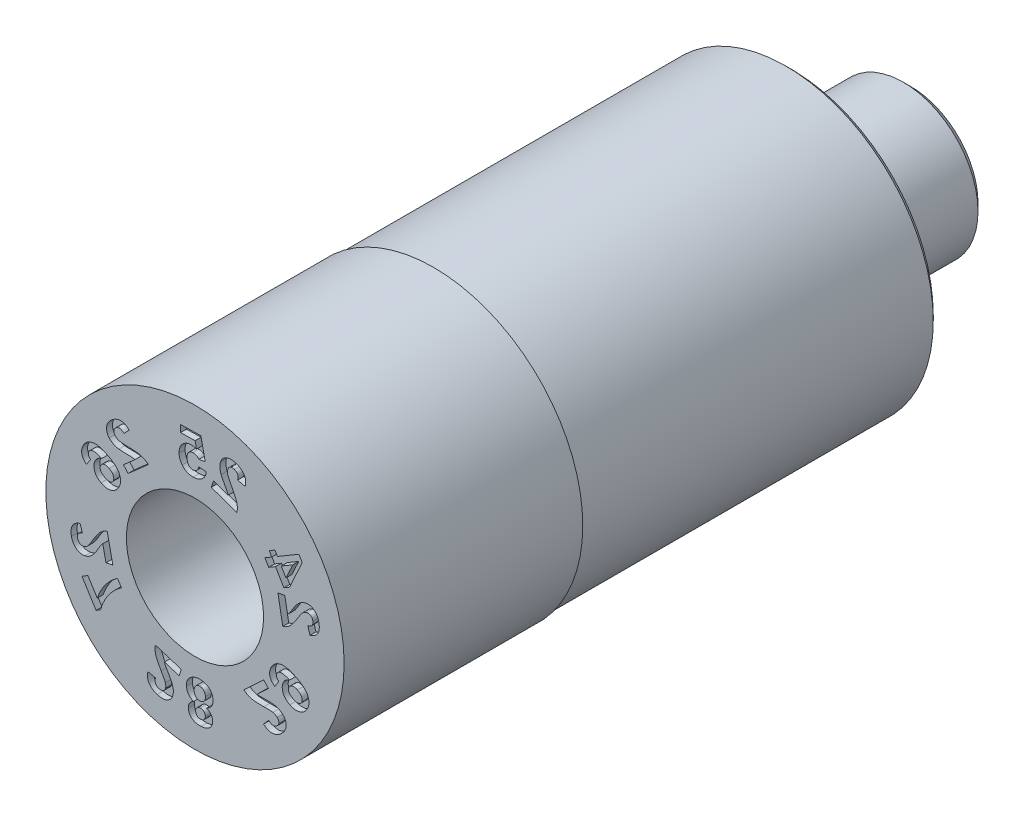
SolidWorks part; units mm, degrees
other "<M5 X .8 SHSS>-<Revolve1>"
ref_plane "Front Plane" through (0, 0, 0) normal (0, 0, 1) x (1, 0, 0)
ref_plane "Top Plane" through (0, 0, 0) normal (0, 1, 0) x (1, 0, 0)
ref_plane "Right Plane" through (0, 0, 0) normal (1, 0, 0) x (0, 0, -1)
sketch "Sketch1" plane through (0, 0, 0) normal (1, 0, 0) x (0, 0, -1)
  line L2 (0, 5) -> (0, 2.3)
  line L3 (19.75, 5) -> (0, 5)
  line L4 (-3.7979, 0) -> (49996.2021, 0) construction
  line L8 (16, 1.25) -> (4, 1.25)
  line L9 (4, 2.3) -> (4, 1.25)
  line L10 (4, 2.3) -> (0, 2.3)
  line L12 (20, 2.5) -> (20, 4.75)
  line L16 (20, 4.75) -> (19.75, 5)
  line L17 (20, 2.5) -> (16, 2.5)
  line L18 (16, 1.25) -> (16, 2.5)
  dimension "D1" = 20
  dimension "D2" = 45
  dimension "D3" = 0.25
  dimension "D4" = 10
  dimension "D5" = 4.6
  dimension "D6" = 4
  dimension "D7" = 2.5
  dimension "D8" = 5
  dimension "D9" = 4
revolve "Revolve1" add sketch "Sketch1" angle 360 about L4
sketch "Sketch4" plane through (0, 0, 0) normal (1, 0, 0) x (0, 0, -1)
  line L0 (0, 0) -> (50000, 0) construction
  line L1 (20, -4.75) -> (20, 4.75) construction
  line L2 (8, 5.935) -> (20, 5.935)
  line L3 (8, 5.935) -> (8, 4.935)
  line L4 (8, 4.935) -> (20, 4.935)
  line L5 (20, 5.935) -> (20, 4.935)
  line L6 (19.75, 5) -> (0, 5) construction
  line L9 (0, 6.2524) -> (0, -6.2524) construction
  dimension "D1" = 1
  dimension "D2" = 0.065
  dimension "D3" = 8
revolve "Cut-Revolve1" cut sketch "Sketch4" angle 360 about L0
sketch "Sketch2" plane through (0, 0, 0) normal (0, 0, 1) x (1, 0, 0)
  line L0 (0, 0) -> (0, 6.5633) construction
  line L1 (0, 0) -> (5.684, 3.2816) construction
  line L2 (0, 0) -> (5.684, -3.2816) construction
  line L3 (0, 0) -> (0, -6.5633) construction
  line L4 (0, 0) -> (-5.684, -3.2816) construction
  line L5 (0, 0) -> (-5.684, 3.2816) construction
  circle A0 centre (0, 0) radius 2.9521 construction
  text T0 "24  25  26  27  28  29" font "Arial" height 1.33
  point P11 (0, 0)
  point P1515 (0, 0.0075)
  point P1516 (0.0075, 0.0075)
  point P1517 (0.0075, 0)
  dimension "D1" = 6
extrude "Cut-Extrude1" cut sketch "Sketch2" against normal blind 0.2
sketch "Sketch3" plane through (0, 0, -4) normal (0, 0, 1) x (1, 0, 0)
  line L0 (0, 0) -> (0, 50000) construction
  line L1 (0.7217, 1.25) -> (-0.7217, 1.25)
  line L2 (-0.7217, 1.25) -> (-1.4434, 0)
  line L3 (-1.4434, 0) -> (-0.7217, -1.25)
  line L4 (-0.7217, -1.25) -> (0.7217, -1.25)
  line L5 (0.7217, -1.25) -> (1.4434, 0)
  line L6 (1.4434, 0) -> (0.7217, 1.25)
  line L7 (0, 0) -> (50000, 0) construction
  circle A0 centre (0, 0) radius 1.25 construction
  circle A1 centre (0, 0) radius 1.25 construction
extrude "Cut-Extrude2" cut sketch "Sketch3" against normal blind 2
inserted part "M5 X .8 SHSS"
move or copy body "Body-Move/Copy2" placed by mates yes
